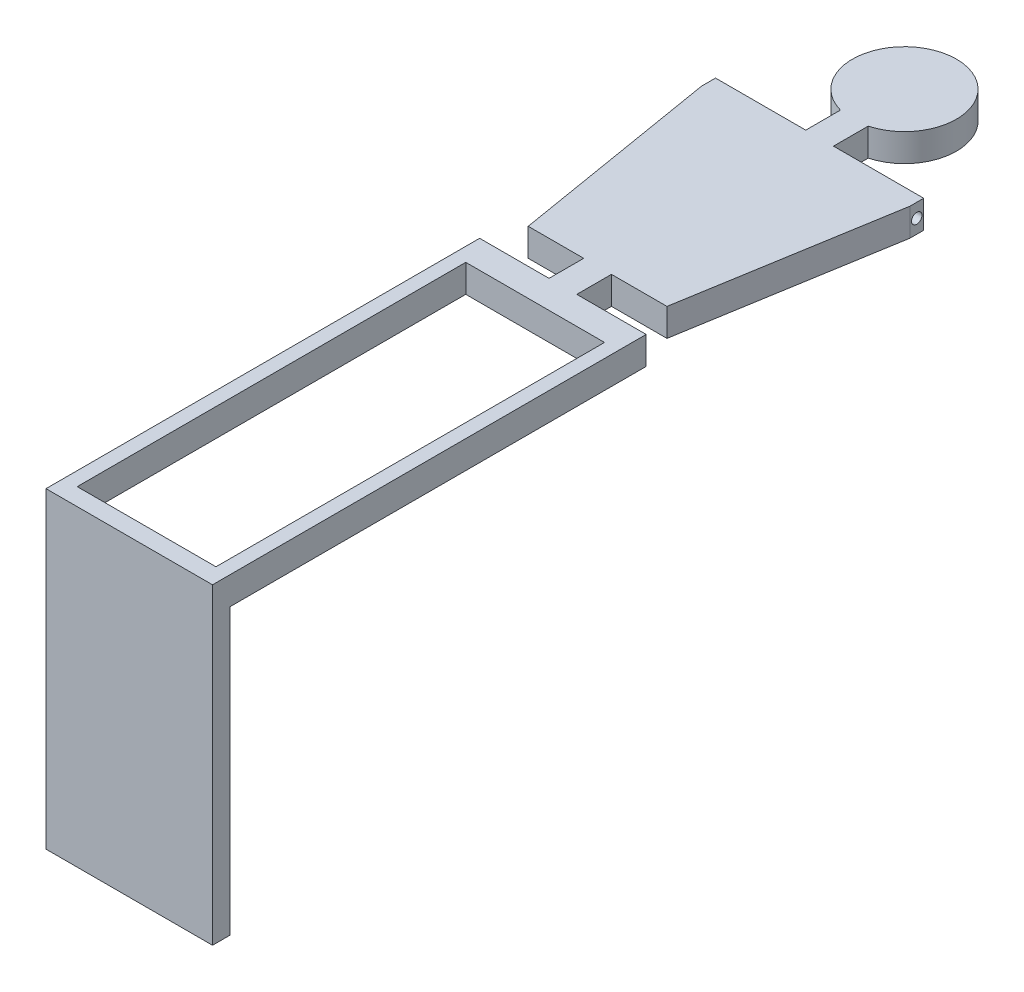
SolidWorks part; units mm, degrees
ref_plane "Plan de face" through (0, 0, 0) normal (0, 0, 1) x (1, 0, 0)
ref_plane "Plan de dessus" through (0, 0, 0) normal (0, 1, 0) x (1, 0, 0)
ref_plane "Plan de droite" through (0, 0, 0) normal (1, 0, 0) x (0, 0, -1)
sketch "Esquisse1" plane through (0, 0, 0) normal (0, 1, 0) x (1, 0, 0)
  line L0 (0, 0) -> (0, 120)
  line L1 (0, 120) -> (-20, 120)
  line L2 (-20, 120) -> (-20, 130)
  line L7 (-28, 130) -> (-28, 120)
  line L8 (-28, 120) -> (-48, 120)
  line L9 (-48, 120) -> (-48, 0)
  line L10 (-48, 0) -> (-44, 0)
  line L11 (-44, 0) -> (-44, 112)
  line L12 (-44, 112) -> (-4, 112)
  line L13 (-4, 112) -> (-4, 0)
  line L14 (-4, 0) -> (0, 0)
  line L21 (-20, 130) -> (-4, 130)
  line L22 (-4, 130) -> (6, 190)
  line L23 (-54, 190) -> (-44, 130)
  line L24 (-44, 130) -> (-28, 130)
  line L25 (-54, 190) -> (-54, 194)
  line L26 (-54, 194) -> (-28, 194)
  line L27 (-28, 194) -> (-28, 204)
  line L29 (-20, 204) -> (-20, 194)
  line L30 (-20, 194) -> (6, 194)
  line L31 (6, 194) -> (6, 190)
  arc A0 (-28, 204) -> (-20, 204) centre (-24, 218.4568) cw
  point P23 (-20, 199)
  point P26 (0, 0)
  point P27 (0, 0)
  dimension "D24" = 15
  dimension "D2" = 120
  dimension "D3" = 40
  dimension "D4" = 120
  dimension "D5" = 10
  dimension "D6" = 4
  dimension "D7" = 8
  dimension "D8" = 20
  dimension "D9" = 4
  dimension "D10" = 4
  dimension "D11" = 10
  dimension "D12" = 10
  dimension "D13" = 4
  dimension "D14" = 8
  dimension "D15" = 0
  dimension "D16" = 4
  dimension "D17" = 8
  dimension "D18" = 60
  dimension "D19" = 4
  dimension "D20" = 26
  dimension "D21" = 0
  dimension "D22" = 64
  dimension "D23" = 4
extrude "Boss.-Extru.1" add sketch "Esquisse1" along normal blind 8
sketch "Esquisse2" plane through (0, 8, 0) normal (0, 1, 0) x (1, 0, 0)
  line L1 (0, 0) -> (-48, 0)
  line L2 (0, 0) -> (0, -5)
  line L3 (0, -5) -> (-48, -5)
  line L4 (-48, 0) -> (-48, -5)
  dimension "D1" = 48
  dimension "D2" = 5
extrude "Boss.-Extru.2" add sketch "Esquisse2" against normal blind 90
sketch "Esquisse3" plane through (-54, 0, 0) normal (-1, 0, 0) x (0, 0, 1)
  line L0 (-194, 8) -> (-194, 0) construction
  line L1 (-194, 8) -> (-190, 8) construction
  circle A0 centre (-192, 4) radius 1.5
  dimension "D3" = 3
  dimension "D1" = 2
  dimension "D2" = 4
extrude "Enlèv. mat.-Extru.1" cut sketch "Esquisse3" against normal through all contours A0
